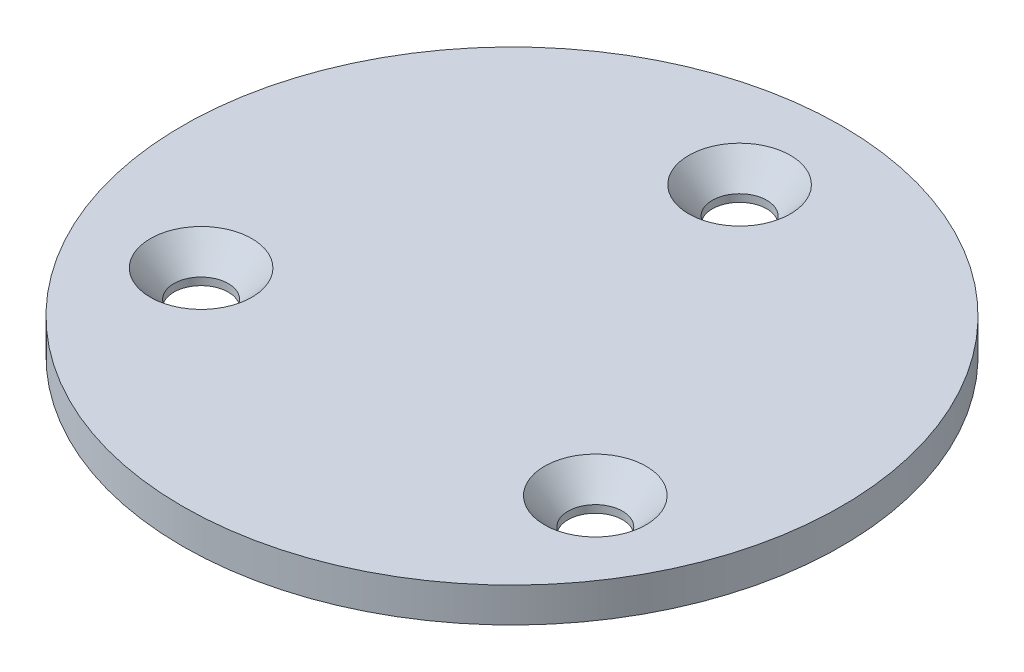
SolidWorks part; units mm, degrees
ref_plane "Front/Back" through (0, 0, 0) normal (0, 0, 1) x (1, 0, 0)
ref_plane "Top/Bottom" through (0, 0, 0) normal (0, 1, 0) x (1, 0, 0)
ref_plane "Right/Left" through (0, 0, 0) normal (1, 0, 0) x (0, 0, -1)
sketch "Sketch1" plane through (0, 0, 0) normal (0, 1, 0) x (1, 0, 0)
  circle A0 centre (0, 0) radius 22.987
  dimension "D1" = 45.974
extrude "Extrude1" add sketch "Sketch1" along normal mid plane 2.413
hole_wizard "CSK for #6 Flat Head Machine Screw2" positions "Sketch4" profile "Sketch3" countersink size "#6" standard "Ansi Inch"
sketch "Sketch4" plane through (0, 1.2065, 0) normal (0, 1, 0) x (-1, 0, 0)
  line L0 (0, 0) -> (0, -24.6154) construction
  line L1 (0, 0) -> (29.5385, 0) construction
  circle A0 centre (0, 0) radius 15.875 construction
  point P0 (0, -15.875)
  dimension "D1" = 31.75
sketch "Sketch3" plane through (0, 1.2065, -15.875) normal (1, 0, 0) x (0, 0, 1)
  line L0 (0, 0) -> (0, 2.413)
  line L1 (0, 2.413) -> (1.8986, 2.413)
  line L2 (1.8986, 2.413) -> (1.8986, 1.892)
  line L3 (1.8986, 1.892) -> (3.5433, 0)
  line L5 (3.5433, 0) -> (0, 0)
  line L6 (-1.8986, 1.892) -> (-3.5433, 0) construction
  line L11 (0, -6.35) -> (0, 107.95) construction
  dimension "Thru Hole Dia." = 3.7973
  dimension "Thru Hole Depth" = 2.413
  dimension "Near C'Sink Dia." = 7.0866
  dimension "Near C'Sink Angle" = 82
pattern_circular "CirPattern1" count 3 over 360 about axis through (0, 0, 0) along (0, 1, 0) of "CSK for #6 Flat Head Machine Screw2"
